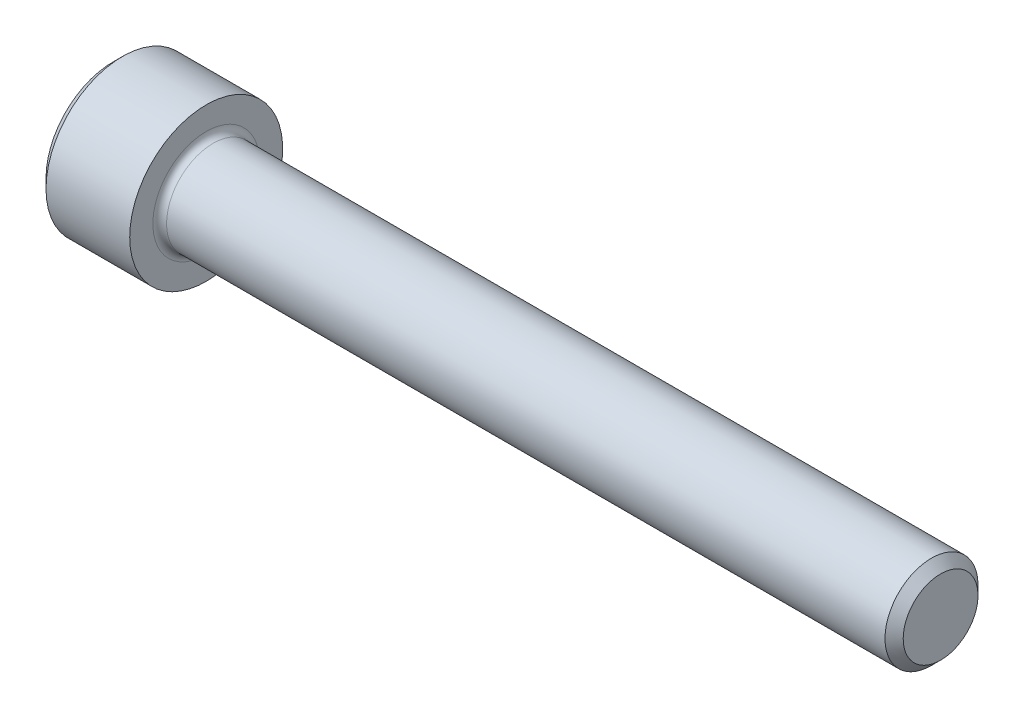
SolidWorks part; units mm, degrees
ref_plane "Plane1" through (0, 0, 0) normal (0, 0, 1) x (1, 0, 0)
ref_plane "Plane2" through (0, 0, 0) normal (0, 1, 0) x (1, 0, 0)
ref_plane "Plane3" through (0, 0, 0) normal (1, 0, 0) x (0, 0, -1)
revolve "Base-Revolve" add sketch "BodySke"
sketch "BodySke" plane through (0, 0, 0) normal (0, 0, 1) x (1, 0, 0)
  line L0 (0, 0) -> (0, 3.4861)
  line L1 (0.4826, 3.9688) -> (4.826, 3.9688)
  line L2 (4.826, 3.9688) -> (4.826, 2.413)
  line L3 (4.826, 2.413) -> (42.4536, 2.413)
  line L4 (42.926, 1.9406) -> (42.926, 0)
  line L5 (42.926, 0) -> (0, 0)
  line L6 (-31.75, 0) -> (127, 0) construction
  line L7 (0, 3.4861) -> (0.4826, 3.9688)
  line L8 (42.926, 1.9406) -> (42.4536, 2.413)
  line L9 (0, -3.4861) -> (0.4826, -3.9688) construction
  line L10 (42.926, -1.9406) -> (42.4536, -2.413) construction
  line L11 (5.6185, 9.525) -> (5.6185, 3.175) construction
  line L12 (14.351, 9.525) -> (14.351, 3.175) construction
  line L13 (4.826, 9.525) -> (4.826, 3.175) construction
  dimension "Diameter" = 4.826
  dimension "Head_ht" = 4.826
  dimension "Length" = 38.1
  dimension "Body_ch_ang" = 45
  dimension "Head_dia" = 7.9375
  dimension "Head_ch_ang" = 45
  dimension "Head_side_ht" = 4.3434
  dimension "Minor_dia" = 3.8811
  dimension "Advance" = 0.7925
  dimension "Thread_nom" = 28.575
  dimension "Thread_length" = 38.1
fillet "Fillet1" radius 0.3556 1 edges at (4.826, 0, 2.413)
sketch "Sketch2" plane through (0, 0, 0) normal (0, 0, 1) x (1, 0, 0)
  line L0 (0, 1.985) -> (2.286, 1.985)
  line L1 (2.286, 1.985) -> (3.432, 0)
  line L2 (-31.75, 0) -> (127, 0) construction
  line L3 (3.432, 0) -> (0, 0)
  line L4 (0, 0) -> (0, 1.985)
  line L5 (0, 3.4861) -> (0, -3.4861) construction
  line L6 (0, 0) -> (47.625, 0) construction
  line L7 (4.826, -3.9688) -> (4.826, 3.9688) construction
  dimension "D1" = 1.985
  dimension "D2" = 60
  dimension "Wall_thickness" = 2.54
revolve "Hex-PreBroach" cut sketch "Sketch2" angle 360 about L6
sketch "Sketch3" plane through (0, 0, 0) normal (-1, 0, 0) x (0, 0.5, 0.866)
  line L0 (1.146, 1.985) -> (-1.146, 1.985)
  line L1 (-1.146, 1.985) -> (-2.2921, 0)
  line L2 (1.146, 1.985) -> (2.2921, 0)
  line L3 (1.146, -1.985) -> (2.2921, 0)
  line L4 (1.146, -1.985) -> (-1.146, -1.985)
  line L5 (-1.146, -1.985) -> (-2.2921, 0)
  dimension "D1" = 1.985
  dimension "D2" = 1.985
  dimension "Hex_size" = 3.97
extrude "Hex" cut sketch "Sketch3" against normal blind 2.286
sketch "Sketch4" plane through (0, 0, 0) normal (-1, 0, 0) x (0, 0, 1)
  line L0 (0, 0) -> (2.3876, 0)
  line L1 (0, 0) -> (6.1484, 3.5498) construction
  line L2 (0, 0) -> (1.1938, 2.0677)
  line L3 (1.9883, 0.576) -> (2.2704, 0.7389)
  line L4 (1.493, 1.4339) -> (1.7751, 1.5968)
  arc A0 (1.9883, 0.576) -> (1.493, 1.4339) centre (0, 0) ccw
  arc A1 (2.3876, 0) -> (2.2704, 0.7389) centre (0, 0) ccw
  arc A2 (1.1938, 2.0677) -> (1.7751, 1.5968) centre (0, 0) cw
  dimension "D1" = 30
  dimension "Spline_n_dim" = 4.1402
  dimension "Spline_m_dim" = 4.7752
  dimension "D2" = 60
  dimension "D3" = 0.4953
  dimension "Spline_p_dim" = 0.9906
extrude "Spline" [suppressed] cut sketch "Sketch4" against normal blind 2.286
pattern_circular "CirPattern1" [suppressed] count 6 every 60
sketch "Sketch5" plane through (0, 0, 0) normal (0, 0, 1) x (1, 0, 0)
  line L0 (-31.75, 0) -> (127, 0) construction
  line L2 (0, 3.4861) -> (0, -3.4861) construction
  circle A0 centre (1.651, 0) radius 0.5905
  dimension "Drilled_hole_dia" = 1.1811
  dimension "Drilled_hole_loc" = 1.651
extrude "Hole" [suppressed] cut sketch "Sketch5" against normal through all and the other way through all
pattern_circular "Drilled-4" [suppressed] count 2 every 60
pattern_circular "Drilled-6" [suppressed] count 3 every 60
sketch "ThdSchSke" plane through (0, 0, 0) normal (0, 0, 1) x (1, 0, 0)
  line L0 (14.351, -1.9406) -> (14.0202, -2.413)
  line L1 (14.351, -1.9406) -> (14.6818, -2.413)
  line L2 (14.6818, -2.413) -> (14.6818, -3.0162)
  line L3 (-3.175, 0) -> (5.1513, 0) construction
  line L5 (14.6818, -3.0162) -> (14.0202, -3.0162)
  line L6 (14.0202, -3.0162) -> (14.0202, -2.413)
  line L7 (0, 3.4861) -> (0, -3.4861) construction
  dimension "Thread_minor" = 3.8811
  dimension "Diameter" = 4.826
  dimension "Start" = 14.351
  dimension "SideAngle" = 55
  dimension "VeeAngle" = 70
  dimension "Overcut" = 6.0325
revolve "ThreadSchematic" [suppressed] cut sketch "ThdSchSke" angle 360 about L3
pattern_linear "ThdSchPat" [suppressed]
equation "\"D2@Sketch3\" = \"Hex_size@Sketch3\" / 2"
equation "\"D1@Sketch3\" = \"Hex_size@Sketch3\" / 2"
equation "\"D1@Sketch2\" = \"Hex_size@Sketch3\" / 2"
equation "\"D3@Sketch4\" = \"Spline_p_dim@Sketch4\" / 2"
equation "\"Thread_minor@ThreadCosmetic\"  =  \"Minor_dia@BodySke\""
equation "\"D2@CirPattern1\" = 360 / \"Num_teeth@CirPattern1\""
equation "\"Wall_thickness@Sketch2\" = \"Head_ht@BodySke\" - \"Key_eng@Hex\""
equation "\"Thread_length@ThreadCosmetic\" = ((sgn( (\"Length@BodySke\" - \"Advance@BodySke\" ) - \"Thread_nom@BodySke\" )-1)*( (\"Length@BodySke\" - \"Advance@BodySke\" ) - \"Thread_nom@BodySke\" ))/-2+ \"Thread_nom@BodySke\""
equation "\"Thread_minor@ThdSchSke\" = \"Minor_dia@BodySke\""
equation "\"Diameter@ThdSchSke\" = \"Diameter@BodySke\""
equation "\"Overcut@ThdSchSke\" = \"Diameter@BodySke\" * 1.25"
equation "\"Start@ThdSchSke\" = \"Head_ht@BodySke\" + \"Length@BodySke\" - \"Thread_length@ThreadCosmetic\"  '---Non-countersunk---"
equation "\"Num_threads@ThdSchPat\" = int( \"Thread_length@ThreadCosmetic\" / \"Advance@BodySke\" + 0.999 )  + 1"
equation "\"Advance@ThdSchPat\" = \"Thread_length@ThreadCosmetic\" /  (\"Num_threads@ThdSchPat\" - 1) 'relax it"
equation "\"Num_threads@ThdSchPat\" = \"Num_threads@ThdSchPat\" - sgn( \"Num_threads@ThdSchPat\" - 1) '---chamfered tips only---"
